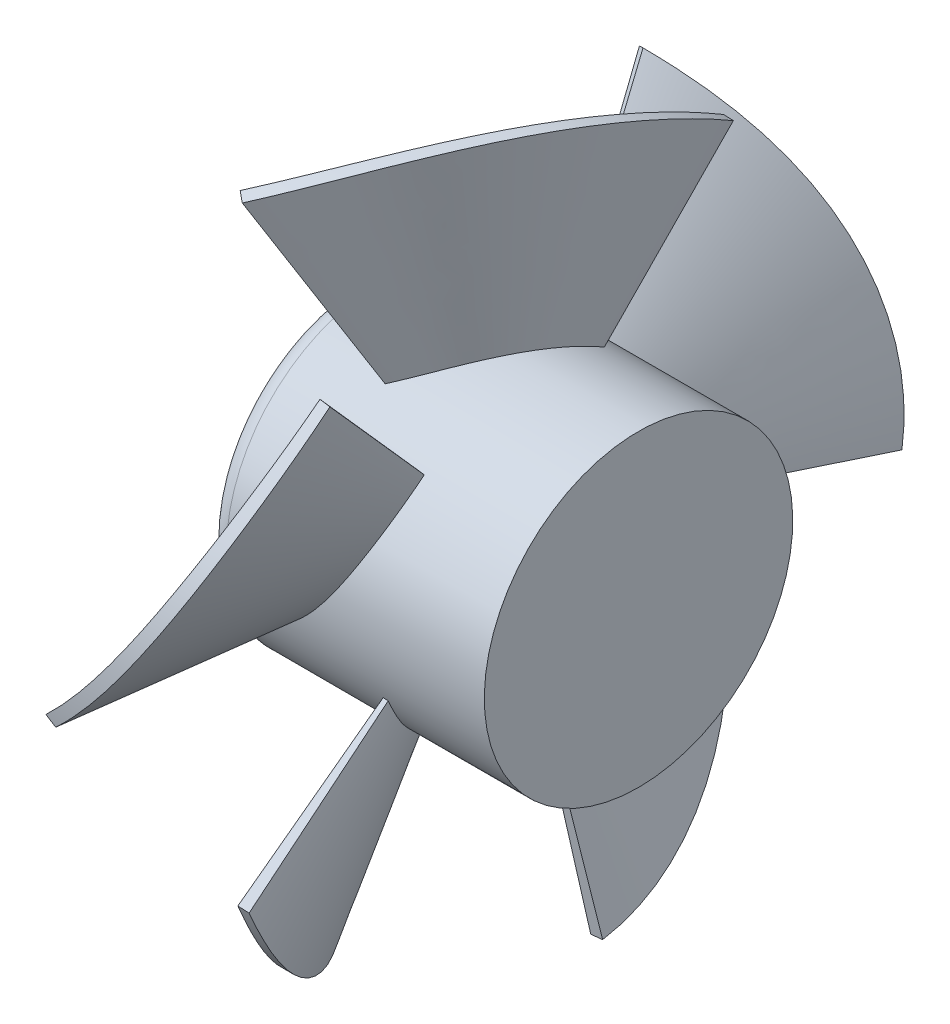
SolidWorks part; units mm, degrees
ref_plane "Front" through (0, 0, 0) normal (0, 0, 1) x (1, 0, 0)
ref_plane "Top" through (0, 0, 0) normal (0, 1, 0) x (1, 0, 0)
ref_plane "Right" through (0, 0, 0) normal (1, 0, 0) x (0, 0, -1)
sketch "Support-Front" plane through (0, 0, 0) normal (0, 0, 1) x (1, 0, 0)
  line L0 (-25.4, 0) -> (-3, 0) construction
  line L1 (-25.4, -12.5) -> (-25.4, 12.5)
  line L2 (-25.4, 12.5) -> (-3, 12.5)
  line L3 (-25.4, -12.5) -> (-3, -12.5)
  line L4 (-3, 12.5) -> (-3, -12.5)
  line L5 (-14.2, 12.5) -> (-14.2, -12.5) construction
  line L6 (-3, 12.5) -> (0, 12.5) construction
  line L7 (-3, -12.5) -> (0, -12.5) construction
  line L8 (0, 12.5) -> (0, -12.5) construction
  line L11 (-14.2, 12.5) -> (-14.2, 28) construction
  line L12 (-14.2, -12.5) -> (-14.2, -28) construction
  point P12 (0, 0)
  point P14 (-14.2, 0)
  dimension "Width" = 25.4
  dimension "Diam-Body" = 25
  dimension "Diam-Fan" = 56
  dimension "Dist-Fan" = 3
sketch "Support-Right" plane through (0, 0, 0) normal (1, 0, 0) x (0, 0, -1)
  line L0 (0, 0) -> (-1.0417, 0) construction
  line L1 (-1.0417, 0) -> (-2.0833, 0) construction
  line L2 (-3.125, 0) -> (-4.1667, 0) construction
  line L3 (-4.1667, 0) -> (-5.2083, 0) construction
  line L4 (-5.2083, 0) -> (-6.25, 0) construction
  line L5 (-2.0833, 0) -> (-3.125, 0) construction
  line L6 (0, 12.5) -> (0, -12.5) construction
  line L7 (0, 12.5) -> (0, -12.5) construction
  line L8 (0.6551, 12.5) -> (0.6551, 11.8449)
  line L9 (-0.6551, 12.5) -> (-0.6551, 11.8449)
  line L10 (0.6551, 12.5) -> (-0.6551, 12.5)
  line L11 (0, 12.5) -> (0, 11.8449) construction
  line L12 (0, 11.8449) -> (0, 11.1898) construction
  line L13 (0, 0) -> (-0.6551, 12.5) construction
  circle A0 centre (0, 0) radius 28
  circle A1 centre (0, 0) radius 6.25
  circle A2 centre (0, 0) radius 4.1667
  circle A3 centre (0, 0) radius 1.0417
  arc A4 (0.6551, 11.8449) -> (-0.6551, 11.8449) centre (0, 11.8449) cw
  dimension "D1" = 3
  dimension "Diam-Motor" = 12.5
sketch "Support-Fan-Blade-Top" plane through (0, 0, 0) normal (0, 1, 0) x (-1, 0, 0)
  line L0 (14.2, 0) -> (24.2349, 13.3168) construction
  line L1 (9.3249, -15.9458) -> (24.2349, 13.3168) construction
  line L2 (16.7799, -1.3145) -> (14.2, 0) construction
  line L4 (25.4, 0) -> (24.2349, 13.3168) construction
  line L5 (25.4, 0) -> (3, 0) construction
  line L6 (23.5529, 14.0482) -> (24.2349, 13.3168)
  line L7 (8.3323, -15.824) -> (9.3249, -15.9458)
  arc A0 (24.2349, 13.3168) -> (9.3249, -15.9458) centre (56.9791, -21.7971) ccw
  arc A1 (23.5529, 14.0482) -> (8.3323, -15.824) centre (56.9791, -21.7971) ccw
  dimension "D2" = 1
  dimension "D1" = 10
  dimension "D3" = 85
  dimension "Angle-Fan-Blade" = 117
ref_plane "Plane-Angle-Fan-Blade" through (-11.2733, 0, -5.744) normal (-0.891, 0, -0.454) x (-0.454, 0, 0.891)
ref_plane "Plane-Top-Fan-Blade" through (0, 28, 0) normal (0, 1, 0) x (-1, 0, 0)
sketch "Sketch-Blade-Bottom" plane through (0, 0, 0) normal (0, 1, 0) x (1, 0, 0)
  point P0 (-14.2, 0)
sketch "Sketch-Blade-Top" plane through (0, 28, 0) normal (0, 1, 0) x (-1, 0, 0)
  line L2 (24.2349, 13.3168) -> (23.5529, 14.0482)
  line L3 (8.3323, -15.824) -> (9.3249, -15.9458)
  line L4 (24.2349, 13.3168) -> (23.5529, 14.0482)
  line L5 (8.3323, -15.824) -> (9.3249, -15.9458)
  arc A3 (23.5529, 14.0482) -> (8.3323, -15.824) centre (56.9791, -21.7971) ccw
  arc A4 (24.2349, 13.3168) -> (9.3249, -15.9458) centre (56.9791, -21.7971) ccw
  arc A5 (23.5529, 14.0482) -> (8.3323, -15.824) centre (56.9791, -21.7971) ccw
  arc A6 (24.2349, 13.3168) -> (9.3249, -15.9458) centre (56.9791, -21.7971) ccw
  dimension "D1" = 0
ref_plane "Plane-Right-Cut" through (-25.4, 0, 0) normal (1, 0, 0) x (0, 0, -1)
sketch "Sketch5" plane through (0, 0, 0) normal (0, 0, 1) x (1, 0, 0)
  line L0 (-3, 12.5) -> (-3, -12.5) construction
  line L1 (-25.4, -12.5) -> (-25.4, 12.5) construction
  line L4 (-3, 12.5) -> (-3, 0)
  line L5 (-25.4, 0) -> (-25.4, 12.5)
  line L6 (-25.4, 0) -> (-3, 0)
  line L7 (-25.4, 12.5) -> (-3, 12.5) construction
  line L8 (-25.4, 0) -> (-3, 0) construction
  line L9 (-25.4, 0) -> (-3, 0) construction
  line L10 (-25.4, 12.5) -> (-3, 12.5)
revolve "Body" add sketch "Sketch5" angle 360 about L9
loft "Loft-Fan-Blade" add profiles "Sketch-Blade-Top", "Sketch-Blade-Bottom"
pattern_circular "CirPattern1" count 5 over 360 about axis through (-25.4, 0, 0) along (1, 0, 0) of "Loft-Fan-Blade"
sketch "Sketch-Cut-Blade" plane through (0, 0, 0) normal (1, 0, 0) x (0, 0, -1)
  circle A0 centre (0, 0) radius 28 construction
  circle A1 centre (0, 0) radius 28
extrude "Cut-Fan-Blade" cut sketch "Sketch-Cut-Blade" against normal through all flip side to cut
sketch "Sketch6" plane through (-25.4, 0, 0) normal (1, 0, 0) x (0, 0, -1)
  circle A0 centre (0, 0) radius 6.25 construction
  circle A1 centre (0, 0) radius 6.25
extrude "Cut-Body" [suppressed] cut sketch "Sketch6" along normal blind 1
sketch "Sketch7" plane through (-25.4, 0, 0) normal (1, 0, 0) x (0, 0, -1)
  circle A0 centre (0, 0) radius 1.0417 construction
  circle A1 centre (0, 0) radius 4.1667 construction
  circle A2 centre (0, 0) radius 1.0417
  circle A3 centre (0, 0) radius 4.1667
extrude "Body-Center" [suppressed] add sketch "Sketch7" along normal up to surface (1 mm away)
fillet "Cosmetic-Fillet" radius 1.5 1 edges at (-25.4, -12.5, 0)
sketch "Sketch8" plane through (-25.4, 0, 0) normal (1, 0, 0) x (0, 0, -1)
  line L0 (0.6551, 12.5) -> (0.6551, 11.8449) construction
  line L1 (0.6551, 12.5) -> (-0.6551, 12.5) construction
  line L2 (-0.6551, 12.5) -> (-0.6551, 11.8449) construction
  line L3 (0.6551, 12.5) -> (0.6551, 11.8449)
  line L4 (0.6551, 12.5) -> (-0.6551, 12.5)
  line L5 (-0.6551, 12.5) -> (-0.6551, 11.8449)
  arc A0 (-0.6551, 11.8449) -> (0.6551, 11.8449) centre (0, 11.8449) ccw construction
  arc A1 (-0.6551, 11.8449) -> (0.6551, 11.8449) centre (0, 11.8449) ccw
extrude "Cut-Body-Cosmetic-Body" [suppressed] cut sketch "Sketch8" along normal up to surface (1 mm away)
pattern_circular "CirPattern-Cut-Body-Cosmetic-Body" [suppressed] count 30 over 360
equation "\"Angle-Blade@Plane-Angle-Fan-Blade\" = \"Angle-Fan-Blade@Support-Fan-Blade-Top\""
equation "\"Rad@Cosmetic-Fillet\" = \"Dist-Fan@Support-Front\" / 2"
equation "\"Diam-Motor@Support-Right\" = \"Diam-Body@Support-Front\" / 2"
equation "\"Depth@Cut-Body\" = \"Dist-Fan@Support-Front\" / 3"
